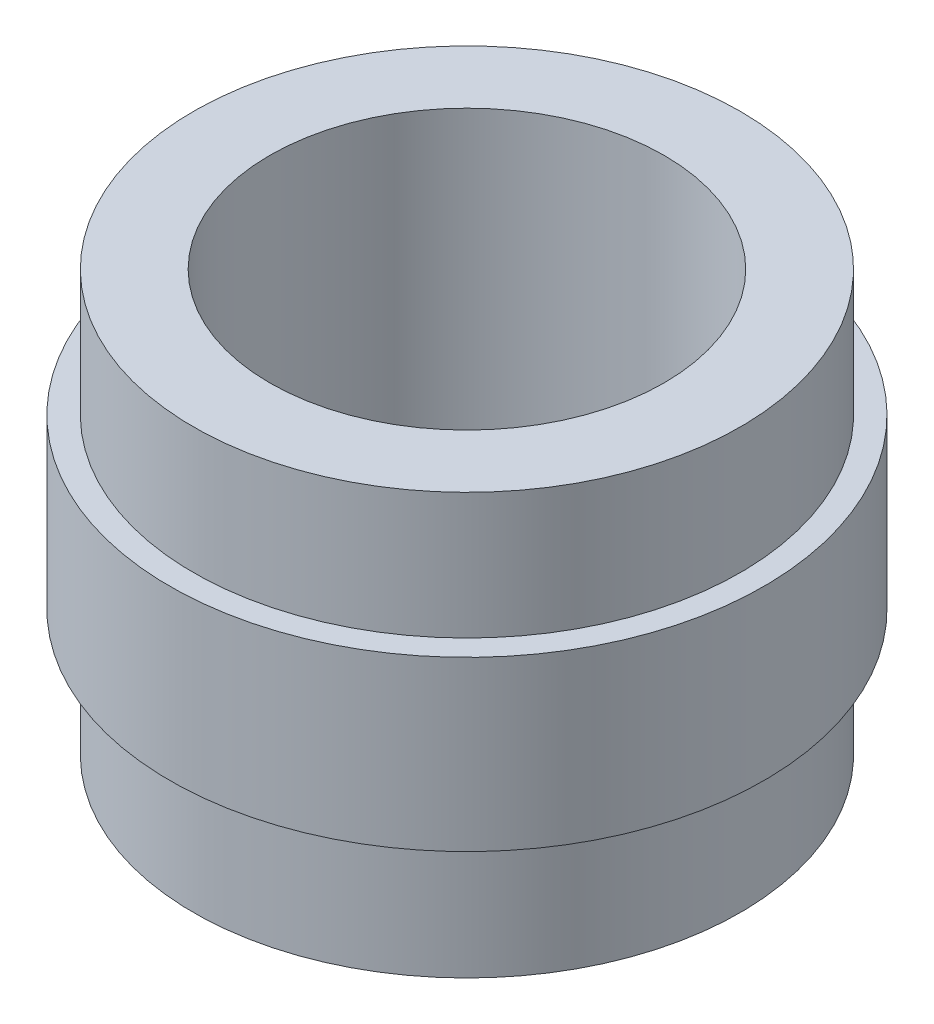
SolidWorks part; units mm, degrees
ref_plane "Plan de face" through (0, 0, 0) normal (0, 0, 1) x (1, 0, 0)
ref_plane "Plan de dessus" through (0, 0, 0) normal (0, 1, 0) x (1, 0, 0)
ref_plane "Plan de droite" through (0, 0, 0) normal (1, 0, 0) x (0, 0, -1)
sketch "Esquisse1" plane through (0, 0, 0) normal (0, 0, 1) x (1, 0, 0)
  line L0 (0, 0) -> (0, 33.5983) construction
  line L1 (1.875, 0) -> (2.6, 0)
  line L2 (1.875, 0) -> (1.875, 4)
  line L3 (1.875, 4) -> (2.6, 4)
  line L4 (2.825, 1.2) -> (2.825, 2.8)
  line L5 (2.6, 4) -> (2.6, 2.8)
  line L6 (2.6, 2.8) -> (2.825, 2.8)
  line L7 (2.825, 1.2) -> (2.6, 1.2)
  line L8 (2.6, 1.2) -> (2.6, 0)
  line L9 (0, 0) -> (2.6, 0) construction
  dimension "D1" = 3.75
  dimension "D2" = 5.65
  dimension "D3" = 4
  dimension "D4" = 5.2
  dimension "D5" = 5.2
  dimension "D6" = 1.2
  dimension "D7" = 1.2
revolve "Révolution1" add sketch "Esquisse1" angle 360 about L0
